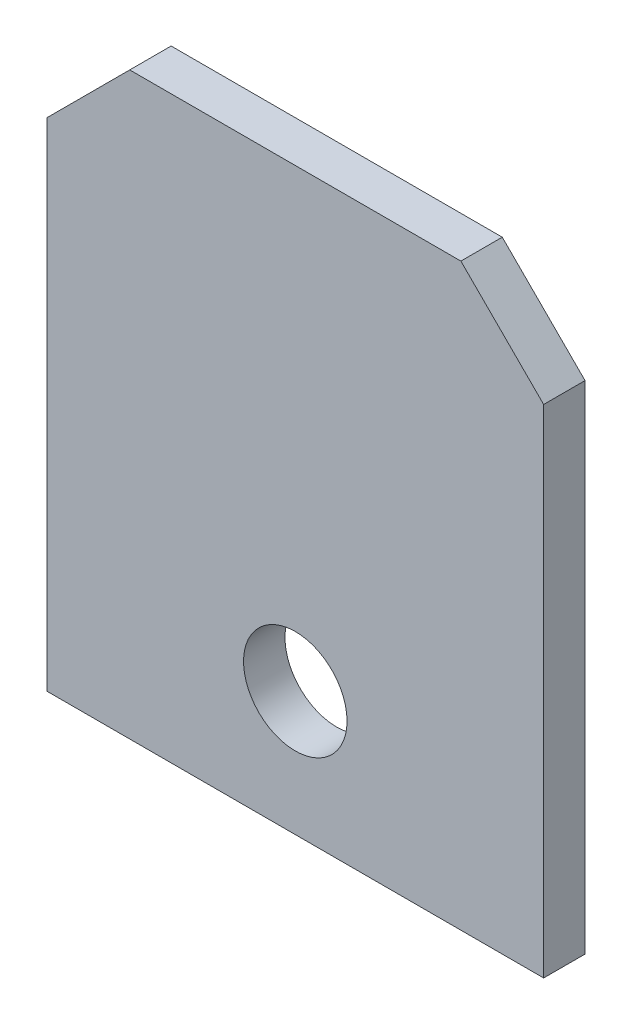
SolidWorks part; units mm, degrees
ref_plane "Front Plane" through (0, 0, 0) normal (0, 0, 1) x (1, 0, 0)
ref_plane "Top Plane" through (0, 0, 0) normal (0, 1, 0) x (1, 0, 0)
ref_plane "Right Plane" through (0, 0, 0) normal (1, 0, 0) x (0, 0, -1)
sketch "Sketch1" plane through (0, 0, 0) normal (0, 0, 1) x (1, 0, 0)
  line L1 (0, 0) -> (76.2, 0)
  line L2 (0, 0) -> (0, -88.9)
  line L3 (0, -88.9) -> (76.2, -88.9)
  line L4 (76.2, 0) -> (76.2, -88.9)
  dimension "D1" = 76.2
  dimension "D2" = 88.9
extrude "Extrude1" add sketch "Sketch1" along normal blind 6.35
sketch "Sketch2" plane through (0, 0, 6.35) normal (0, 0, 1) x (1, 0, 0)
  line L0 (0, -88.9) -> (76.2, -88.9) construction
  line L1 (0, 0) -> (0, -88.9) construction
  circle A0 centre (38.1, -69.85) radius 7.9375
  dimension "D1" = 19.05
  dimension "D2" = 38.1
extrude "Cut-Extrude1" cut sketch "Sketch2" against normal through all
chamfer "Chamfer1" distance 12.7 angle 45 1 edges at (0, 0, 3.175)
chamfer "Chamfer2" distance 12.7 angle 45 1 edges at (76.2, 0, 3.175)
